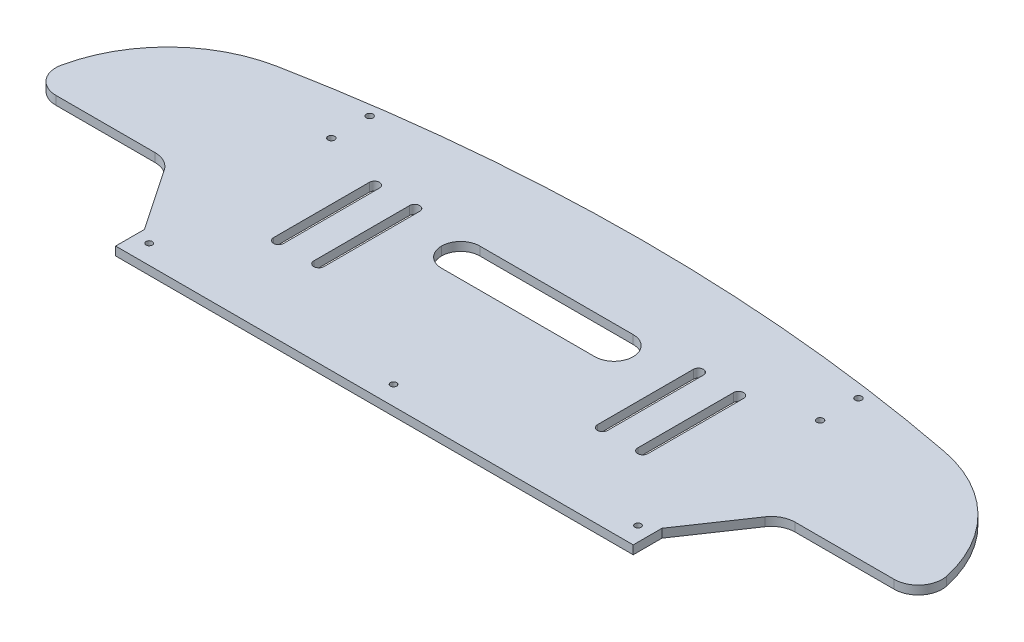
SolidWorks part; units mm, degrees
ref_plane "Front Plane" through (0, 0, 0) normal (0, 0, 1) x (1, 0, 0)
ref_plane "Top Plane" through (0, 0, 0) normal (0, 1, 0) x (1, 0, 0)
ref_plane "Right Plane" through (0, 0, 0) normal (1, 0, 0) x (0, 0, -1)
sketch "Sketch1" plane through (0, 0, 0) normal (0, 1, 0) x (1, 0, 0)
  line L20 (0, 0) -> (-130, 0)
  line L44 (0, 360) -> (0, 320)
  line L45 (0, 320) -> (-100, 320)
  line L46 (-100, 320) -> (-100, 280)
  line L47 (-100, 280) -> (0, 280)
  line L57 (-270, 360) -> (-270, 130) construction
  line L68 (-270, 360) -> (-270, 390) construction
  line L77 (-60, 150) -> (-60, 110) construction
  line L78 (-240, -990) -> (-240, 360) construction
  line L79 (-110, -80) -> (-50, -80) construction
  line L80 (-110, -80) -> (-110, -120) construction
  line L81 (-110, -120) -> (-50, -120) construction
  line L82 (-50, -80) -> (-50, -120) construction
  line L95 (-255, 150) -> (-255, 110) construction
  line L105 (0, 80) -> (-130, 80)
  line L106 (0, 280) -> (0, 80)
  line L119 (-270, 130) -> (-270, -990) construction
  line L122 (-270, 130) -> (-270, 160)
  line L125 (-240, 360) -> (-270, 360) construction
  line L128 (-270, 360) -> (-270, -990) construction
  line L135 (-270, -990) -> (-240, -990)
  line L136 (-240, -990) -> (-240, 360) construction
  line L137 (-150, 60) -> (-150, 20)
  line L138 (-60, 150) -> (0, 150) construction
  line L141 (0, 110) -> (-60, 110) construction
  line L171 (0, 0) -> (0, -990)
  line L180 (-240, -990) -> (0, -990)
  line L184 (-255, 150) -> (-255, 340) construction
  line L188 (-255, 340) -> (-255, 360) construction
  line L189 (-255, 130) -> (-270, 130) construction
  line L191 (-112, -406.4839) -> (112, -406.4839) construction
  line L193 (-112, -406.4839) -> (-112, -646.4839) construction
  line L194 (-112, -646.4839) -> (112, -646.4839) construction
  line L195 (112, -406.4839) -> (112, -646.4839) construction
  line L204 (-270, 130) -> (0, 130)
  line L205 (-270, 160) -> (-465, 235) construction
  line L206 (-465, 235) -> (-465, 360) construction
  line L207 (-465, 360) -> (-270, 360) construction
  line L208 (-190, 320) -> (-190, 220) construction
  line L209 (-184.75, 320) -> (-184.75, 220)
  line L210 (-195.25, 320) -> (-195.25, 220)
  line L211 (-148, 320) -> (-148, 220) construction
  line L212 (-142.75, 320) -> (-142.75, 220)
  line L213 (-153.25, 320) -> (-153.25, 220)
  line L215 (-18.067, 103.9496) -> (-60, 58.9394)
  line L216 (-60, 150) -> (0, 150) construction
  line L218 (-240, 360) -> (0, 360) construction
  line L219 (0, 360) -> (0, 410)
  line L220 (0, 410) -> (-439.637, 410) construction
  line L221 (-465, 235) -> (-270, 235) construction
  line L222 (-270, 160) -> (-320.7495, 235)
  line L223 (-320.7495, 235) -> (-465, 235)
  circle A16 centre (-60, 110) radius 3.25
  circle A17 centre (-110, -80) radius 3.25
  circle A18 centre (-110, -120) radius 3.25
  circle A19 centre (-50, -80) radius 3.25 construction
  circle A20 centre (-50, -120) radius 3.25 construction
  circle A45 centre (-168.5, 329.3859) radius 4 construction
  circle A47 centre (-126.5, 329.3859) radius 4 construction
  circle A49 centre (-168.5, 329.3859) radius 4 construction
  circle A51 centre (-126.5, 329.3859) radius 4 construction
  circle A53 centre (-147.2402, 299.3859) radius 4 construction
  circle A55 centre (-147.2402, 299.3859) radius 4 construction
  arc A57 (0, 110) -> (-18.067, 103.9496) centre (0, 80) ccw
  circle A59 centre (-112, -406.4839) radius 3.5
  circle A63 centre (-255, 340) radius 3.5
  arc A64 (-150, 20) -> (-130, 0) centre (-130, 20) ccw
  circle A66 centre (-112, -646.4839) radius 3.5
  arc A68 (-184.75, 320) -> (-195.25, 320) centre (-190, 320) ccw
  circle A69 centre (-255, 150) radius 3.25
  arc A70 (-130, 80) -> (-150, 60) centre (-130, 60) ccw
  arc A152 (-195.25, 220) -> (-184.75, 220) centre (-190, 220) ccw
  arc A154 (-142.75, 320) -> (-153.25, 320) centre (-148, 320) ccw
  arc A156 (-153.25, 220) -> (-142.75, 220) centre (-148, 220) ccw
  circle A164 centre (0, 150) radius 3.25
  circle A166 centre (-50, -100) radius 3.25
  arc A170 (-465, 235) -> (-348.1556, 376.6231) centre (-320.7495, 235) cw
  arc A172 (-348.1556, 376.6231) -> (0, 410) centre (0, -1422.5) cw
  circle A184 centre (-255, 380) radius 3.5
  circle A190 centre (-255, 110) radius 3.25
  point P2 (-346.1797, 378.0134)
  point P7 (0, 0)
  point P8 (0, 0)
  point P43 (0, -646.4839)
  point P63 (-190, 270)
  point P70 (-148, 270)
  point P104 (-150, 0)
  point P211 (-150, 80)
  dimension "D12" = 40
  dimension "D17" = 30
  dimension "D22" = 130
  dimension "D23" = 30
  dimension "D24" = 50
  dimension "D26" = 1350
  dimension "D27" = 270
  dimension "D31" = 20
  dimension "D39" = 6.5
  dimension "D28" = 42
  dimension "D6" = 990
  dimension "D8" = 40
  dimension "D9" = 50
  dimension "D11" = 30
  dimension "D14" = 7
  dimension "D29" = 5.25
  dimension "D36" = 7
  dimension "D7" = 20
  dimension "D10" = 150
  dimension "D15" = 40
  dimension "D16" = 224
  dimension "D18" = 240
  dimension "D20" = 80
  dimension "D21" = 465
  dimension "D25" = 125
  dimension "D30" = 100
  dimension "D32" = 40
  dimension "D33" = 60
  dimension "D34" = 50
  dimension "D35" = 190
  dimension "D37" = 40
  dimension "D46" = 100
  dimension "D49" = 40
  dimension "D51" = 60
extrude "Boss-Extrude1" add sketch "Sketch1" along normal blind 9
fillet "Fillet2" radius 20 2 edges at (-100, 4.5, -320) (-100, 4.5, -280)
fillet "Fillet3" radius 25 2 edges at (-320.7495, 4.5, -235) (-465, 4.5, -235)
mirror "Mirror1" about plane through (0, 0, 0) normal (1, 0, 0) of "Fillet3", "Boss-Extrude1", "Fillet2"
